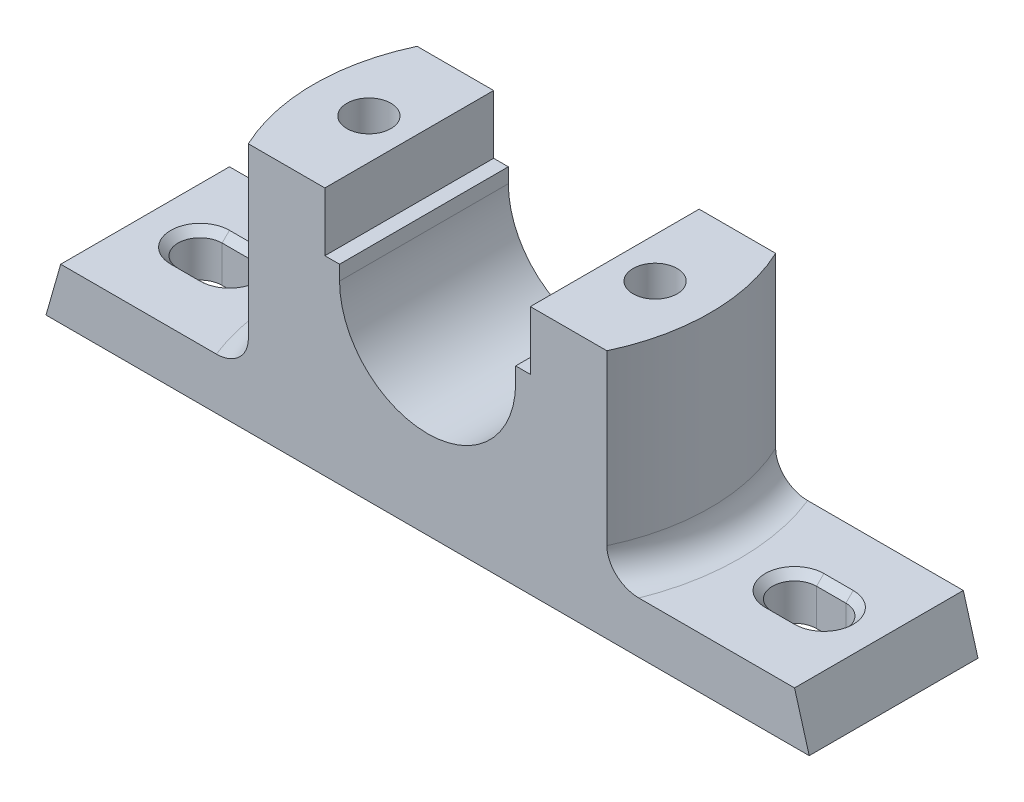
SolidWorks part; units mm, degrees
ref_plane "Front Plane" through (0, 0, 0) normal (0, 0, 1) x (1, 0, 0)
ref_plane "Top Plane" through (0, 0, 0) normal (0, 1, 0) x (1, 0, 0)
ref_plane "Right Plane" through (0, 0, 0) normal (1, 0, 0) x (0, 0, -1)
sketch "Sketch1" plane through (0, 0, 0) normal (0, 0, 1) x (1, 0, 0)
  line L0 (0, 67.1528) -> (0, 0) construction
  line L1 (-104, 0) -> (104, 0)
  line L2 (104, 0) -> (100, 14)
  line L3 (-104, 0) -> (-100, 14)
  line L4 (100, 14) -> (54, 14)
  line L5 (-100, 14) -> (-54, 14)
  line L6 (54, 14) -> (54, 68)
  line L7 (-54, 14) -> (-54, 68)
  line L8 (54, 68) -> (28, 68)
  line L9 (-54, 68) -> (-28, 68)
  line L10 (28, 68) -> (28, 52)
  line L11 (-28, 68) -> (-28, 52)
  line L12 (28, 52) -> (24, 52)
  line L13 (-28, 52) -> (-24, 52)
  line L14 (-24, 52) -> (-24, 48)
  line L16 (24, 52) -> (24, 48)
  arc A0 (-24, 48) -> (24, 48) centre (0, 48) ccw
  dimension "D6" = 16
  dimension "D8" = 48
  dimension "D1" = 208
  dimension "D2" = 14
  dimension "D3" = 4
  dimension "D4" = 54
  dimension "D5" = 56
  dimension "D7" = 68
  dimension "D9" = 4
extrude "Extrude1" add sketch "Sketch1" along normal mid plane 46
sketch "Sketch2" plane through (0, 68, 0) normal (0, 1, 0) x (1, 0, 0)
  line L0 (54, 23) -> (28, 23) construction
  line L1 (-48.8569, -23) -> (48.8569, -23)
  line L2 (-54, -23) -> (-54, 23) construction
  line L3 (-48.8569, 23) -> (48.8569, 23)
  line L5 (-48.8569, -23) -> (48.8569, 23) construction
  line L6 (-48.8569, 23) -> (48.8569, -23) construction
  arc A0 (-48.8569, 23) -> (-48.8569, -23) centre (0, 0) ccw
  arc A1 (48.8569, 23) -> (48.8569, -23) centre (0, 0) cw
  point P0 (0, 0)
extrude "Extrude2" cut sketch "Sketch2" against normal up to surface (54 mm away) flip side to cut
sketch "Sketch4" plane through (0, 0, 0) normal (0, -1, 0) x (1, 0, 0)
  line L1 (-97.5, -17.5) -> (97.5, -17.5)
  line L2 (-97.5, -17.5) -> (-97.5, 17.5)
  line L3 (-97.5, 17.5) -> (97.5, 17.5)
  line L4 (97.5, -17.5) -> (97.5, 17.5)
  line L5 (-97.5, -17.5) -> (97.5, 17.5) construction
  line L6 (-97.5, 17.5) -> (97.5, -17.5) construction
  point P0 (0, 0)
  dimension "D1" = 195
  dimension "D2" = 35
extrude "Extrude3" cut sketch "Sketch4" against normal blind 2
sketch "Sketch5" plane through (0, 2, 0) normal (0, -1, 0) x (1, 0, 0)
  line L0 (0, 14.9766) -> (0, -13) construction
  line L1 (-52, -13) -> (-26, -13)
  line L2 (-52, -13) -> (-52, 13)
  line L3 (-52, 13) -> (-26, 13)
  line L4 (-26, -13) -> (-26, 13)
  line L5 (-52, -13) -> (-26, 13) construction
  line L6 (-52, 13) -> (-26, -13) construction
  line L7 (26, -13) -> (52, -13)
  line L8 (26, -13) -> (26, 13)
  line L9 (26, 13) -> (52, 13)
  line L10 (52, -13) -> (52, 13)
  line L11 (26, -13) -> (52, 13) construction
  line L12 (26, 13) -> (52, -13) construction
  point P0 (-39, 0)
  point P5 (39, 0)
  dimension "D1" = 26
  dimension "D2" = 78
extrude "Extrude4" cut sketch "Sketch5" against normal blind 10
sketch "Sketch6" plane through (0, 68, 0) normal (0, 1, 0) x (1, 0, 0)
  point P0 (-39, 0)
  point P1 (39, 0)
  dimension "D1" = 78
  dimension "D2" = 39
other "Hole1"
sketch "Sketch8" plane through (0, 68, 0) normal (0, 1, 0) x (-1, 0, 0)
  circle A0 centre (39, 0) radius 6
  dimension "D1" = 12
other "Hole2"
sketch "Sketch9" plane through (0, 68, 0) normal (0, 1, 0) x (-1, 0, 0)
  circle A0 centre (-39, 0) radius 6
  dimension "D1" = 12
fillet "Fillet1" radius 8 2 edges at (-54, 14, 0) (54, 14, 0)
sketch "Sketch10" plane through (0, 14, 0) normal (0, 1, 0) x (1, 0, 0)
  line L0 (0, 0) -> (0, 41.3672) construction
  line L1 (-85, -6) -> (-77, -6)
  line L2 (85, 6) -> (77, -6) construction
  line L3 (-85, 6) -> (-77, 6)
  line L4 (85, -6) -> (77, 6) construction
  line L5 (-85, -6) -> (-77, 6) construction
  line L6 (-85, 6) -> (-77, -6) construction
  line L7 (85, 6) -> (77, 6)
  line L8 (85, -6) -> (77, -6)
  arc A0 (-85, 6) -> (-85, -6) centre (-85, 0) ccw
  arc A1 (-77, -6) -> (-77, 6) centre (-77, 0) ccw
  arc A2 (77, -6) -> (77, 6) centre (77, 0) cw
  arc A3 (85, 6) -> (85, -6) centre (85, 0) cw
  point P0 (-81, 0)
  point P13 (81, 0)
  dimension "D1" = 6
  dimension "D2" = 8
  dimension "D3" = 77
extrude "Extrude5" cut sketch "Sketch10" against normal through all
chamfer "Chamfer2" distance 2 angle 45 8 edges at (81, 14, 6) (91, 14, 0) (71, 14, 0) (81, 14, -6) (-81, 14, 6) (-71, 14, 0) (-91, 14, 0) (-81, 14, -6)
